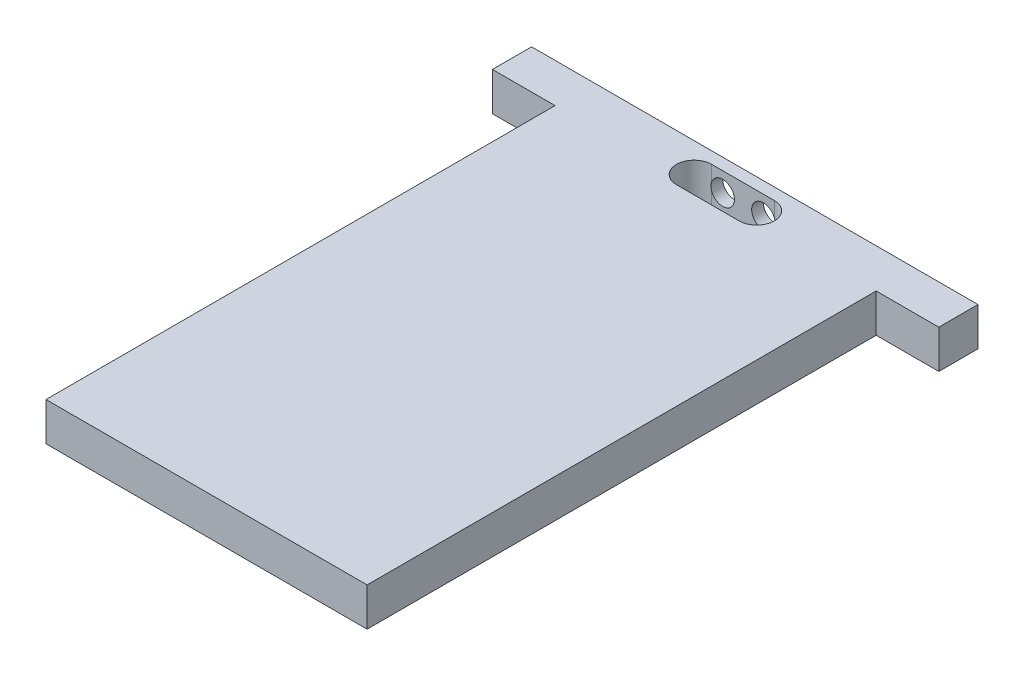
SolidWorks part; units mm, degrees
ref_plane "Front Plane" through (0, 0, 0) normal (0, 0, 1) x (1, 0, 0)
ref_plane "Top Plane" through (0, 0, 0) normal (0, 1, 0) x (1, 0, 0)
ref_plane "Right Plane" through (0, 0, 0) normal (1, 0, 0) x (0, 0, -1)
sketch "Sketch1" plane through (0, 0, 0) normal (0, 0, 1) x (1, 0, 0)
  line L1 (-20.5, -2.45) -> (20.5, -2.45)
  line L2 (-20.5, -2.45) -> (-20.5, 2.45)
  line L3 (-20.5, 2.45) -> (20.5, 2.45)
  line L4 (20.5, -2.45) -> (20.5, 2.45)
  line L5 (-20.5, -2.45) -> (20.5, 2.45) construction
  line L6 (-20.5, 2.45) -> (20.5, -2.45) construction
  point P0 (0, 0)
  dimension "D1" = 41
  dimension "D2" = 4.9
extrude "Boss-Extrude1" add sketch "Sketch1" along normal mid plane 65
sketch "Sketch2" plane through (0, 0, -32.5) normal (0, 0, 1) x (1, 0, 0)
  line L0 (20.5, -2.45) -> (20.5, 2.45) construction
  line L1 (-28.5, -2.45) -> (28.5, -2.45)
  line L2 (-28.5, -2.45) -> (-28.5, 2.45)
  line L3 (-28.5, 2.45) -> (28.5, 2.45)
  line L4 (28.5, -2.45) -> (28.5, 2.45)
  line L5 (-28.5, -2.45) -> (28.5, 2.45) construction
  line L6 (-28.5, 2.45) -> (28.5, -2.45) construction
  line L7 (0, 0) -> (0, -7.2336) construction
  dimension "D1" = 4.9
  dimension "D2" = 8
extrude "Boss-Extrude2" add sketch "Sketch2" against normal blind 5
sketch "Sketch3" plane through (0, 2.45, 0) normal (0, 1, 0) x (1, 0, 0)
  line L1 (28.5, 37.5) -> (-28.5, 37.5) construction
  line L2 (-4, 33.75) -> (4, 33.75) construction
  line L3 (-4, 36) -> (4, 36)
  line L4 (-4, 31.5) -> (4, 31.5)
  arc A1 (-4, 36) -> (-4, 31.5) centre (-4, 33.75) ccw
  arc A2 (4, 31.5) -> (4, 36) centre (4, 33.75) ccw
  circle A3 centre (0, 37.5) radius 2.5 construction
  point P0 (0, 33.75)
  point P1 (0, 33.75)
  point P4 (0, 37.5)
  dimension "D1" = 3.75
  dimension "D2" = 4.5
  dimension "D4" = 5
  dimension "D3" = 8
extrude "Cut-Extrude1" cut sketch "Sketch3" against normal through all
sketch "Sketch4" plane through (0, 0, -37.5) normal (0, 0, -1) x (-1, 0, 0)
  line L0 (0, 0) -> (0, 2.2954) construction
  circle A1 centre (2.6, 0) radius 1.5
  circle A2 centre (-2.6, 0) radius 1.5
  dimension "D1" = 3
  dimension "D2" = 2.6
extrude "Cut-Extrude2" cut sketch "Sketch4" against normal up to next
